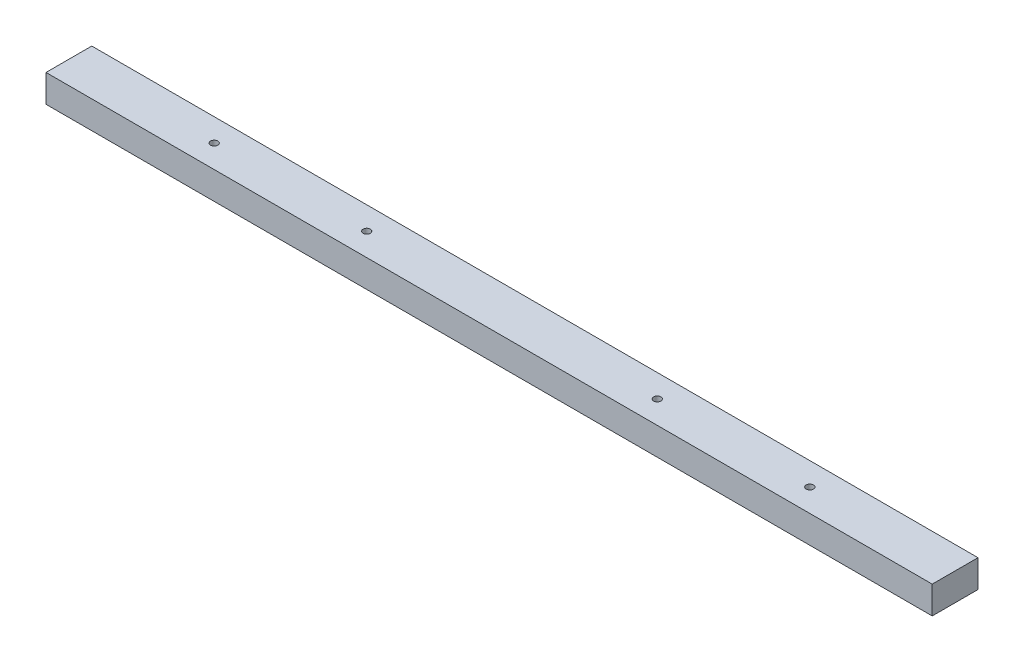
SolidWorks part; units mm, degrees
ref_plane "Front Plane" through (0, 0, 0) normal (0, 0, 1) x (1, 0, 0)
ref_plane "Top Plane" through (0, 0, 0) normal (0, 1, 0) x (1, 0, 0)
ref_plane "Right Plane" through (0, 0, 0) normal (1, 0, 0) x (0, 0, -1)
sketch "Sketch1" plane through (0, 0, 0) normal (0, 1, 0) x (1, 0, 0)
  line L1 (0, 0) -> (1220, 0)
  line L2 (0, 0) -> (0, 63)
  line L3 (0, 63) -> (1220, 63)
  line L4 (1220, 0) -> (1220, 63)
  dimension "D1" = 1220
  dimension "D2" = 63
extrude "Boss-Extrude1" add sketch "Sketch1" along normal blind 38
sketch "Sketch2" plane through (0, 38, 0) normal (0, 1, 0) x (1, 0, 0)
  line L0 (0, 31.5) -> (1220, 31.5) construction
  line L1 (0, 63) -> (0, 0) construction
  line L2 (1220, 0) -> (1220, 63) construction
  line L3 (200, 31.5) -> (410, 31.5) construction
  line L4 (610, 63) -> (610, 0) construction
  line L5 (1220, 63) -> (0, 63) construction
  line L6 (0, 0) -> (1220, 0) construction
  circle A0 centre (200, 31.5) radius 5
  circle A2 centre (410, 31.5) radius 5
  circle A3 centre (810, 31.5) radius 5
  circle A4 centre (1020, 31.5) radius 5
extrude "Cut-Extrude1" cut sketch "Sketch2" against normal blind 38
equation "\"Hole Diameter\"= 10"
equation "\"D1@Sketch2\"=\"Hole Diameter\""
